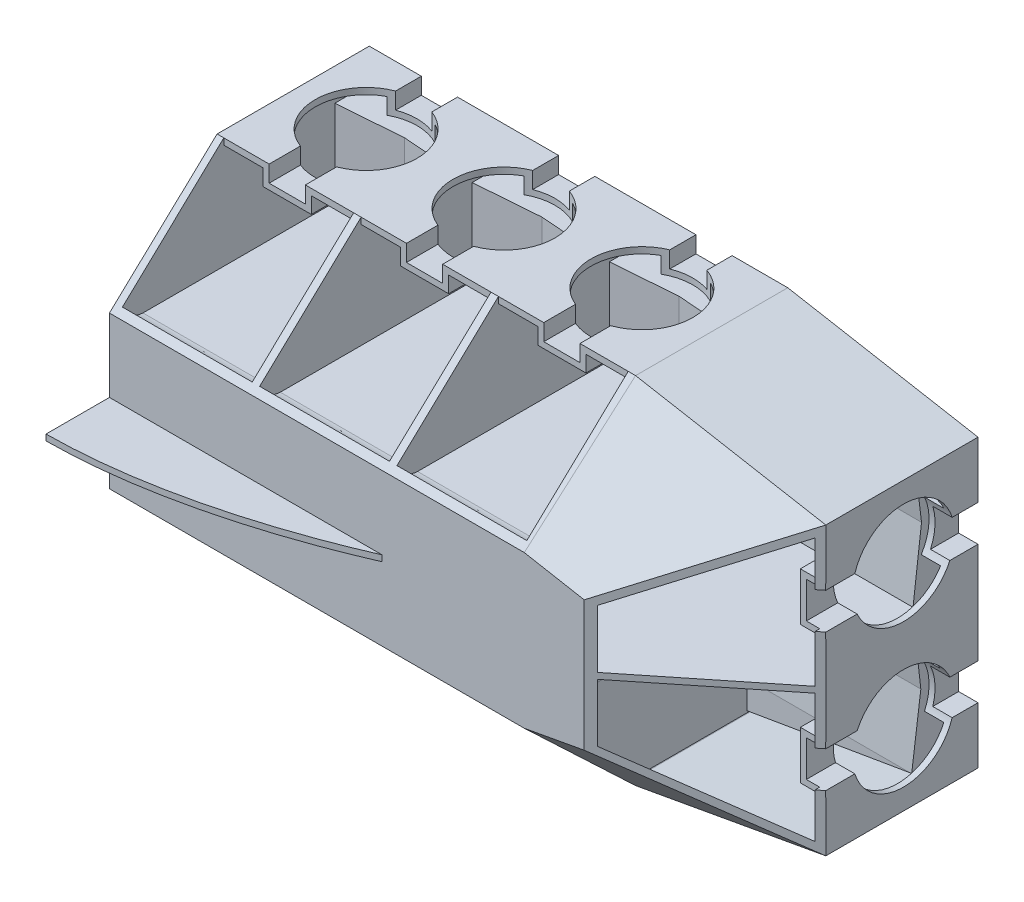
SolidWorks part; units mm, degrees
ref_plane "Front Plane" through (0, 0, 0) normal (0, 0, 1) x (1, 0, 0)
ref_plane "Top Plane" through (0, 0, 0) normal (0, 1, 0) x (1, 0, 0)
ref_plane "Right Plane" through (0, 0, 0) normal (1, 0, 0) x (0, 0, -1)
sketch "Sketch1" plane through (0, 0, 0) normal (0, 0, 1) x (1, 0, 0)
  line L1 (-60.96, 35.56) -> (60.96, 35.56)
  line L2 (-60.96, 35.56) -> (-60.96, -35.56)
  line L3 (-60.96, -35.56) -> (60.96, -35.56)
  line L4 (60.96, 35.56) -> (60.96, -35.56)
  line L5 (-60.96, 35.56) -> (60.96, -35.56) construction
  line L6 (-60.96, -35.56) -> (60.96, 35.56) construction
  point P0 (0, 0)
  dimension "D1" = 121.92
  dimension "D2" = 71.12
extrude "Boss-Extrude1" add sketch "Sketch1" along normal blind 30.48
sketch "Sketch2" plane through (0, 0, 30.48) normal (0, 0, 1) x (1, 0, 0)
  line L0 (0, 0) -> (60.96, 0) construction
  line L1 (60.96, -35.56) -> (60.96, 35.56) construction
  line L2 (60.96, 35.56) -> (60.96, 28.6956)
  line L3 (60.96, 35.56) -> (22.86, 35.56)
  line L4 (60.96, 35.56) -> (-60.96, 35.56) construction
  line L5 (22.86, 35.56) -> (60.96, 28.6956)
  line L6 (22.86, -35.56) -> (60.96, -28.6957)
  line L7 (60.96, -35.56) -> (22.86, -35.56)
  line L8 (60.96, -35.56) -> (60.96, -28.6957)
extrude "Cut-Extrude1" cut sketch "Sketch2" against normal through all
ref_plane "Plane1" through (0, 0, 50.8) normal (0, 0, 1) x (1, 0, 0)
sketch "Sketch3" plane through (0, 0, 50.8) normal (0, 0, 1) x (1, 0, 0)
  line L0 (34.0885, 0) -> (60.96, 0) construction
  line L2 (-61.0091, -15.24) -> (-61.0091, 15.24)
  line L3 (-61.0091, 15.24) -> (22.087, 15.24)
  line L4 (34.0885, -13.0429) -> (34.0885, 13.0429)
  line L5 (60.96, -28.6957) -> (60.96, 28.6956) construction
  line L6 (34.0885, 13.0429) -> (22.087, 15.24)
  line L7 (34.0885, -13.0429) -> (22.087, -15.24)
  line L8 (-61.0091, -15.24) -> (22.087, -15.24)
  point P8 (34.0885, 13.0429)
  point P9 (22.087, 15.24)
  dimension "D3" = 2.1971
extrude "Boss-Extrude2" add sketch "Sketch3" along normal blind 1.2 separate body
loft "Loft1" add
sketch "Sketch4" plane through (0, 0, 50.8) normal (0, 0, 1) x (1, 0, 0)
  line L0 (-42.0831, -34.29) -> (-33.6091, -34.29)
  line L1 (-59.6091, -15.29) -> (-33.6091, -15.29)
  line L2 (-59.6091, -15.29) -> (-59.6091, -34.29)
  line L3 (-59.6091, -34.29) -> (-51.7351, -34.29)
  line L4 (-33.6091, -15.29) -> (-33.6091, -34.29)
  line L5 (-61.0091, 0) -> (-61.0091, -52.4041) construction
  line L6 (-61.0091, 15.24) -> (-61.0091, -15.24) construction
  line L7 (-14.5831, -34.29) -> (-6.1091, -34.29)
  line L13 (-51.7351, -34.29) -> (-51.7351, -31.04)
  line L14 (-51.7351, -31.04) -> (-42.0831, -31.04)
  line L15 (-42.0831, -34.29) -> (-42.0831, -31.04)
  line L16 (-32.1091, -15.29) -> (-6.1091, -15.29)
  line L17 (-32.1091, -15.29) -> (-32.1091, -34.29)
  line L18 (-32.1091, -34.29) -> (-24.2351, -34.29)
  line L19 (-6.1091, -15.29) -> (-6.1091, -34.29)
  line L20 (-24.2351, -34.29) -> (-24.2351, -31.04)
  line L21 (-24.2351, -31.04) -> (-14.5831, -31.04)
  line L22 (-14.5831, -34.29) -> (-14.5831, -31.04)
  line L23 (-33.5091, 0) -> (-33.5091, -52.4041) construction
  line L24 (12.9169, -34.29) -> (21.3909, -34.29)
  line L25 (-4.6091, -15.29) -> (21.3909, -15.29)
  line L26 (-4.6091, -15.29) -> (-4.6091, -34.29)
  line L27 (-4.6091, -34.29) -> (3.2649, -34.29)
  line L28 (21.3909, -15.29) -> (21.3909, -34.29)
  line L29 (3.2649, -34.29) -> (3.2649, -31.04)
  line L30 (3.2649, -31.04) -> (12.9169, -31.04)
  line L31 (12.9169, -34.29) -> (12.9169, -31.04)
  line L32 (-6.0091, 0) -> (-6.0091, -52.4041) construction
  line L33 (-61.0091, 0) -> (34.27, 0) construction
  line L34 (12.9169, 34.29) -> (12.9169, 31.04)
  line L35 (3.2649, 31.04) -> (12.9169, 31.04)
  line L36 (3.2649, 34.29) -> (3.2649, 31.04)
  line L37 (21.3909, 15.29) -> (21.3909, 34.29)
  line L38 (-4.6091, 34.29) -> (3.2649, 34.29)
  line L39 (-4.6091, 15.29) -> (-4.6091, 34.29)
  line L40 (-4.6091, 15.29) -> (21.3909, 15.29)
  line L41 (12.9169, 34.29) -> (21.3909, 34.29)
  line L42 (-14.5831, 34.29) -> (-14.5831, 31.04)
  line L43 (-24.2351, 31.04) -> (-14.5831, 31.04)
  line L44 (-24.2351, 34.29) -> (-24.2351, 31.04)
  line L45 (-6.1091, 15.29) -> (-6.1091, 34.29)
  line L46 (-32.1091, 34.29) -> (-24.2351, 34.29)
  line L47 (-32.1091, 15.29) -> (-32.1091, 34.29)
  line L48 (-32.1091, 15.29) -> (-6.1091, 15.29)
  line L49 (-42.0831, 34.29) -> (-42.0831, 31.04)
  line L50 (-51.7351, 31.04) -> (-42.0831, 31.04)
  line L51 (-51.7351, 34.29) -> (-51.7351, 31.04)
  line L52 (-14.5831, 34.29) -> (-6.1091, 34.29)
  line L53 (-33.6091, 15.29) -> (-33.6091, 34.29)
  line L54 (-59.6091, 34.29) -> (-51.7351, 34.29)
  line L55 (-59.6091, 15.29) -> (-59.6091, 34.29)
  line L56 (-59.6091, 15.29) -> (-33.6091, 15.29)
  line L57 (-42.0831, 34.29) -> (-33.6091, 34.29)
  dimension "D1" = 19
  dimension "D2" = 1.4
  dimension "D3" = 26
  dimension "D4" = 3.25
  dimension "D5" = 3
extrude "Cut-Extrude2" cut sketch "Sketch4" against normal through all
shell "Shell2" thickness 1.2
ref_plane "Plane2" through (22.59, 0, 0) normal (1, 0, 0) x (0, 0, -1)
other "Intersect1"
sketch "Sketch5" plane through (0, 0, 52) normal (0, 0, 1) x (1, 0, 0)
  line L0 (-19.4091, 31.04) -> (-19.4091, -38.0658) construction
  line L1 (-24.2351, 31.04) -> (-14.5831, 31.04) construction
  line L2 (-19.4091, 31.04) -> (-19.4091, 41.9044) construction
  line L3 (-14.5831, 31.04) -> (-14.5831, 34.29) construction
  line L4 (-23.0351, 47.5938) -> (-15.7831, 47.5938)
  line L5 (-23.0351, 47.5938) -> (-23.0351, 32.24)
  line L6 (-23.0351, 32.24) -> (-15.7831, 32.24)
  line L7 (-15.7831, 47.5938) -> (-15.7831, 32.24)
  line L8 (-23.0351, 47.5938) -> (-15.7831, 32.24) construction
  line L9 (-23.0351, 32.24) -> (-15.7831, 47.5938) construction
  line L10 (4.4649, 47.5938) -> (11.7169, 47.5938)
  line L11 (4.4649, 47.5938) -> (4.4649, 32.24)
  line L12 (4.4649, 32.24) -> (11.7169, 32.24)
  line L13 (11.7169, 47.5938) -> (11.7169, 32.24)
  line L14 (4.4649, 47.5938) -> (11.7169, 32.24) construction
  line L15 (4.4649, 32.24) -> (11.7169, 47.5938) construction
  line L16 (-50.5351, 47.5938) -> (-43.2831, 47.5938)
  line L17 (-50.5351, 47.5938) -> (-50.5351, 32.24)
  line L18 (-50.5351, 32.24) -> (-43.2831, 32.24)
  line L19 (-43.2831, 47.5938) -> (-43.2831, 32.24)
  line L20 (-50.5351, 47.5938) -> (-43.2831, 32.24) construction
  line L21 (-50.5351, 32.24) -> (-43.2831, 47.5938) construction
  line L22 (-61.0091, 0) -> (34.0885, 0) construction
  line L23 (-61.0091, 15.24) -> (-61.0091, -15.24) construction
  line L24 (34.0885, -13.0429) -> (34.0885, 13.0429) construction
  line L25 (-50.5351, -32.24) -> (-43.2831, -47.5938) construction
  line L26 (-50.5351, -47.5938) -> (-43.2831, -32.24) construction
  line L27 (-43.2831, -47.5938) -> (-43.2831, -32.24)
  line L28 (-50.5351, -32.24) -> (-43.2831, -32.24)
  line L29 (-50.5351, -47.5938) -> (-50.5351, -32.24)
  line L30 (-50.5351, -47.5938) -> (-43.2831, -47.5938)
  line L31 (-23.0351, -32.24) -> (-15.7831, -47.5938) construction
  line L32 (-23.0351, -47.5938) -> (-15.7831, -32.24) construction
  line L33 (-15.7831, -47.5938) -> (-15.7831, -32.24)
  line L34 (-23.0351, -32.24) -> (-15.7831, -32.24)
  line L35 (-23.0351, -47.5938) -> (-23.0351, -32.24)
  line L36 (-23.0351, -47.5938) -> (-15.7831, -47.5938)
  line L37 (4.4649, -32.24) -> (11.7169, -47.5938) construction
  line L38 (4.4649, -47.5938) -> (11.7169, -32.24) construction
  line L39 (11.7169, -47.5938) -> (11.7169, -32.24)
  line L40 (4.4649, -32.24) -> (11.7169, -32.24)
  line L41 (4.4649, -47.5938) -> (4.4649, -32.24)
  line L42 (4.4649, -47.5938) -> (11.7169, -47.5938)
  point P4 (-19.4091, 39.9169)
  point P13 (8.0909, 39.9169)
  point P18 (-46.9091, 39.9169)
  point P32 (-46.9091, -39.9169)
  point P37 (-19.4091, -39.9169)
  point P42 (8.0909, -39.9169)
  dimension "D1" = 1.2
  dimension "D2" = 7.252
  dimension "D3" = 1.2
  dimension "D4" = 2
  dimension "D5" = 2
extrude "Cut-Extrude3" cut sketch "Sketch5" against normal through all
sketch "Sketch6" plane through (0, 0, 1.2) normal (0, 0, 1) x (1, 0, 0)
  line L0 (59.76, 27.6925) -> (59.76, -27.6925) construction
  line L1 (59.76, -27.6925) -> (59.76, 27.6925) construction
  line L2 (59.76, 0) -> (22.59, 0) construction
  line L3 (22.59, -14.09) -> (22.59, 14.09) construction
  line L5 (22.59, -0.6) -> (59.76, -0.6)
  line L7 (22.59, -0.6) -> (22.59, 0.6)
  line L8 (22.59, 0.6) -> (59.76, 0.6)
  line L9 (59.76, -0.6) -> (59.76, 0.6)
  dimension "D1" = 0.6
extrude "Boss-Extrude3" add sketch "Sketch6" along normal up to surface (49.6 mm away)
sketch "Sketch7" plane through (0, -0.6, 0) normal (0, -1, 0) x (1, 0, 0)
  line L0 (34.0885, 52) -> (60.96, 30.48)
  line L1 (60.96, 30.48) -> (60.96, 52.4326)
  line L2 (60.96, 52.4326) -> (34.0885, 52)
extrude "Cut-Extrude4" cut sketch "Sketch7" against normal blind 2
sketch "Sketch8" plane through (0, 35.56, 0) normal (0, 1, 0) x (1, 0, 0)
  line L0 (-46.9091, 0) -> (-46.9091, -33.9961) construction
  line L1 (-50.5351, 0) -> (-43.2831, 0) construction
  line L2 (-43.2831, -33.9961) -> (-50.5351, -33.9961) construction
  circle A0 centre (-46.9091, -14.6875) radius 10.2
  circle A1 centre (-19.2891, -14.6875) radius 10.2
  circle A2 centre (8.3309, -14.6875) radius 10.2
  dimension "D1" = 14.6875
extrude "Cut-Extrude5" cut sketch "Sketch8" against normal blind 6
sketch "Sketch9" plane through (0, -35.56, 0) normal (0, -1, 0) x (1, 0, 0)
  line L0 (-46.9091, 0) -> (-46.9091, 33.9961) construction
  line L1 (-43.2831, 0) -> (-50.5351, 0) construction
  line L2 (-50.5351, 33.9961) -> (-43.2831, 33.9961) construction
  circle A0 centre (-46.9091, 14.9225) radius 10.2
  circle A1 centre (-19.2891, 14.9225) radius 10.2
  circle A2 centre (8.3309, 14.9225) radius 10.2
  dimension "D1" = 14.9225
extrude "Cut-Extrude6" cut sketch "Sketch9" against normal blind 6
sketch "Sketch11" plane through (0, 0, 0) normal (0, 0, -1) x (-1, 0, 0)
  line L0 (-60.96, 0) -> (60.96, 0) construction
  line L1 (-60.96, -28.6957) -> (-60.96, 28.6956) construction
  line L2 (60.96, 35.56) -> (60.96, -35.56) construction
  line L3 (-55.88, -18.57) -> (-55.88, -8.92)
  line L4 (-60.96, 18.57) -> (-55.88, 18.57)
  line L5 (-60.96, 18.57) -> (-60.96, 8.92)
  line L6 (-60.96, 8.92) -> (-55.88, 8.92)
  line L7 (-55.88, 18.57) -> (-55.88, 8.92)
  line L8 (-60.96, -8.92) -> (-55.88, -8.92)
  line L9 (-60.96, -18.57) -> (-60.96, -8.92)
  line L10 (-60.96, -18.57) -> (-55.88, -18.57)
  dimension "D1" = 9.65
  dimension "D2" = 5.08
  dimension "D3" = 8.92
extrude "Boss-Extrude5" add sketch "Sketch11" against normal blind 30.5
sketch "Sketch12" plane through (0, 0, 0) normal (0, 0, -1) x (-1, 0, 0)
  line L0 (-60.96, 0) -> (60.96, 0) construction
  line L1 (-60.96, -28.6957) -> (-60.96, 28.6956) construction
  line L2 (60.96, 35.56) -> (60.96, -35.56) construction
  line L3 (-57.08, -17.37) -> (-57.08, -10.12)
  line L4 (-60.96, 17.37) -> (-57.08, 17.37)
  line L5 (-60.96, 17.37) -> (-60.96, 10.12)
  line L6 (-60.96, 10.12) -> (-57.08, 10.12)
  line L7 (-57.08, 17.37) -> (-57.08, 10.12)
  line L8 (-60.96, -10.12) -> (-57.08, -10.12)
  line L9 (-60.96, -17.37) -> (-60.96, -10.12)
  line L10 (-60.96, -17.37) -> (-57.08, -17.37)
  dimension "D1" = 3.88
  dimension "D2" = 7.25
  dimension "D3" = 10.12
extrude "Cut-Extrude8" cut sketch "Sketch12" against normal through all
sketch "Sketch10" plane through (60.96, 0, 0) normal (1, 0, 0) x (0, 0, -1)
  line L0 (-31.441, 5.36) -> (0, 5.36) construction
  line L1 (-31.441, 0.6) -> (-31.441, 10.12) construction
  line L2 (0, -28.6957) -> (0, -17.37) construction
  line L3 (-30.48, 0) -> (0, 0) construction
  line L5 (0, 0) -> (0, 28.6956) construction
  line L6 (0, 14.3478) -> (-33.7652, 14.3478) construction
  circle A0 centre (-14.9225, 14.3478) radius 10.2
  circle A1 centre (-14.9225, -14.3478) radius 10.2
  dimension "D1" = 14.9225
extrude "Cut-Extrude9" cut sketch "Sketch10" against normal blind 10
sketch "Sketch13" plane through (0, -35.56, 0) normal (0, -1, 0) x (1, 0, 0)
  line L0 (-60.96, 30.48) -> (22.86, 30.48) construction
  line L1 (-32.1076, 37.5203) -> (-6.1118, 37.5203)
  line L2 (-59.6076, 37.5203) -> (-33.6118, 37.5203)
  line L3 (-59.6076, 37.5203) -> (-59.6076, 30.48)
  line L4 (-59.6076, 30.48) -> (-33.6118, 30.48)
  line L5 (-33.6118, 37.5203) -> (-33.6118, 30.48)
  line L6 (-32.1076, 37.5203) -> (-32.1076, 30.48)
  line L7 (-32.1076, 30.48) -> (-6.1118, 30.48)
  line L8 (-6.1118, 37.5203) -> (-6.1118, 30.48)
  line L9 (-4.6076, 37.5203) -> (21.3882, 37.5203)
  line L10 (-4.6076, 37.5203) -> (-4.6076, 30.48)
  line L11 (-4.6076, 30.48) -> (21.3882, 30.48)
  line L12 (21.3882, 37.5203) -> (21.3882, 30.48)
extrude "Cut-Extrude11" cut sketch "Sketch13" against normal blind 10
sketch "Sketch14" plane through (0, 35.56, 0) normal (0, 1, 0) x (1, 0, 0)
  line L0 (-60.96, -30.48) -> (22.86, -30.48) construction
  line L1 (-59.6091, -50.8) -> (-59.6091, -31.825) construction
  line L2 (-59.6091, -37.2397) -> (-33.6091, -37.2397)
  line L3 (-59.6091, -37.2397) -> (-59.6091, -30.48)
  line L4 (-59.6091, -30.48) -> (-33.6091, -30.48)
  line L5 (-33.6091, -37.2397) -> (-33.6091, -30.48)
  line L6 (-33.6091, -31.825) -> (-33.6091, -50.8) construction
  line L7 (-32.1091, -37.2397) -> (-6.1091, -37.2397)
  line L8 (-32.1091, -37.2397) -> (-32.1091, -30.48)
  line L9 (-32.1091, -30.48) -> (-6.1091, -30.48)
  line L10 (-6.1091, -37.2397) -> (-6.1091, -30.48)
  line L11 (-4.6091, -37.2397) -> (21.3909, -37.2397)
  line L12 (-4.6091, -37.2397) -> (-4.6091, -30.48)
  line L13 (-4.6091, -30.48) -> (21.3909, -30.48)
  line L14 (21.3909, -37.2397) -> (21.3909, -30.48)
extrude "Cut-Extrude12" cut sketch "Sketch14" against normal blind 10
sketch "Sketch15" plane through (0, 0, 0) normal (0, 0, -1) x (-1, 0, 0)
  line L0 (4.6091, -15.29) -> (4.6091, -34.29) construction
  line L1 (-21.3909, -15.29) -> (4.6091, -15.29)
  line L2 (-21.3909, -15.29) -> (-21.3909, -30.4528)
  line L3 (-21.3909, -30.4528) -> (4.6091, -30.4528)
  line L4 (4.6091, -15.29) -> (4.6091, -30.4528)
  line L13 (-60.96, 0) -> (60.96, 0) construction
  line L14 (-60.96, -10.12) -> (-60.96, 10.12) construction
  line L15 (60.96, 35.56) -> (60.96, -35.56) construction
  line L28 (-21.3909, -15.29) -> (4.6091, -15.29) construction
  line L29 (6.1091, -15.29) -> (6.1091, -30.4528)
  line L30 (6.1091, -15.29) -> (32.1091, -15.29)
  line L31 (32.1091, -15.29) -> (32.1091, -30.4528)
  line L32 (6.1091, -30.4528) -> (32.1091, -30.4528)
  line L33 (33.6091, -15.29) -> (33.6091, -30.4528)
  line L34 (33.6091, -15.29) -> (59.6091, -15.29)
  line L35 (59.6091, -15.29) -> (59.6091, -30.4528)
  line L36 (33.6091, -30.4528) -> (59.6091, -30.4528)
  line L37 (33.6091, 30.4528) -> (59.6091, 30.4528)
  line L38 (59.6091, 15.29) -> (59.6091, 30.4528)
  line L39 (33.6091, 15.29) -> (59.6091, 15.29)
  line L40 (33.6091, 15.29) -> (33.6091, 30.4528)
  line L41 (6.1091, 30.4528) -> (32.1091, 30.4528)
  line L42 (32.1091, 15.29) -> (32.1091, 30.4528)
  line L43 (6.1091, 15.29) -> (32.1091, 15.29)
  line L44 (6.1091, 15.29) -> (6.1091, 30.4528)
  line L45 (4.6091, 15.29) -> (4.6091, 30.4528)
  line L46 (-21.3909, 30.4528) -> (4.6091, 30.4528)
  line L47 (-21.3909, 15.29) -> (-21.3909, 30.4528)
  line L48 (-21.3909, 15.29) -> (4.6091, 15.29)
extrude "Boss-Extrude6" add sketch "Sketch15" against normal blind 8.255
sketch "Sketch19" plane through (0, 0, 1.2) normal (0, 0, 1) x (1, 0, 0)
  line L0 (22.59, 0.6) -> (22.7528, 34.36)
  line L1 (22.7528, 34.36) -> (55.88, 28.3916)
  line L7 (55.88, 0.6) -> (22.59, 0.6)
  line L8 (61.087, 0) -> (14.2317, 0.2259) construction
  line L11 (55.88, 28.3916) -> (55.88, 0.6)
  line L12 (55.8745, -0.5498) -> (22.586, -0.2288)
  line L13 (22.586, -0.2288) -> (22.4232, -33.9888)
  line L14 (55.6065, -28.34) -> (55.8745, -0.5498)
  line L15 (22.4232, -33.9888) -> (55.6065, -28.34)
extrude "Boss-Extrude8" add sketch "Sketch19" along normal blind 6.731
sketch "Sketch20" plane through (55.88, 0, 0) normal (1, 0, 0) x (0, 0, -1)
  line L0 (-7.931, 14.4958) -> (0.3326, 14.4958) construction
  line L1 (-7.931, 0.6) -> (-7.931, 28.3916) construction
  line L2 (-7.931, 28.3916) -> (-6.2303, 14.4958)
  line L3 (-6.2303, 14.4958) -> (-7.931, 0.6)
  line L4 (-7.931, 0.6) -> (-7.931, 28.3916)
  line L5 (-30.48, 0) -> (0, 0) construction
  line L6 (-30.48, -8.92) -> (-30.48, 8.92) construction
  line L7 (-7.931, -28.3916) -> (-6.2303, -14.4958)
  line L8 (-7.931, -0.6) -> (-7.931, -28.3916)
  line L9 (-6.2303, -14.4958) -> (-7.931, -0.6)
extrude "Cut-Extrude15" cut sketch "Sketch20" against normal up to surface (33.29 mm away)
sketch "Sketch21" plane through (0, 30.4528, 0) normal (0, 1, 0) x (1, 0, 0)
  line L0 (8.3909, -8.255) -> (8.0909, 0) construction
  line L1 (-4.6091, -8.255) -> (21.3909, -8.255) construction
  line L2 (4.4649, 0) -> (11.7169, 0) construction
  line L3 (-4.6091, -8.255) -> (8.3546, -7.2557)
  line L4 (8.3546, -7.2557) -> (21.3909, -8.255)
  line L5 (21.3909, -8.255) -> (-4.6091, -8.255)
  line L6 (-32.1091, -8.255) -> (-19.1454, -7.2557)
  line L7 (-19.1454, -7.2557) -> (-6.1091, -8.255)
  line L8 (-6.1091, -8.255) -> (-32.1091, -8.255)
  line L9 (-59.6091, -8.255) -> (-46.6454, -7.2557)
  line L10 (-46.6454, -7.2557) -> (-33.6091, -8.255)
  line L11 (-33.6091, -8.255) -> (-59.6091, -8.255)
  dimension "D1" = 1
extrude "Cut-Extrude16" cut sketch "Sketch21" against normal up to surface (15.1628 mm away)
sketch "Sketch22" plane through (0, -30.4528, 0) normal (0, -1, 0) x (1, 0, 0)
  line L0 (-46.6091, 8.255) -> (-46.6091, 0) construction
  line L1 (-33.6091, 8.255) -> (-59.6091, 8.255) construction
  line L2 (-59.6091, 8.255) -> (-46.6091, 7.255)
  line L3 (-46.6091, 7.255) -> (-33.6091, 8.255)
  line L4 (-33.6091, 8.255) -> (-59.6091, 8.255)
  line L5 (-32.1091, 8.255) -> (-19.1091, 7.255)
  line L6 (-19.1091, 7.255) -> (-6.1091, 8.255)
  line L7 (-6.1091, 8.255) -> (-32.1091, 8.255)
  line L8 (-4.6091, 8.255) -> (8.3909, 7.255)
  line L9 (8.3909, 7.255) -> (21.3909, 8.255)
  line L10 (21.3909, 8.255) -> (-4.6091, 8.255)
  dimension "D1" = 1
extrude "Cut-Extrude17" cut sketch "Sketch22" against normal up to surface (15.1628 mm away)
sketch "Sketch23" plane through (0, 0, 52) normal (0, 0, 1) x (1, 0, 0)
  line L0 (-61.0091, 0) -> (34.0885, 0) construction
  line L1 (-61.0091, 15.24) -> (-61.0091, -15.24) construction
  line L2 (34.0885, -13.0429) -> (34.0885, 13.0429) construction
  line L3 (-61.0091, -0.6) -> (-6.3991, -0.6)
  line L5 (-61.0091, -0.6) -> (-61.0091, 0.6)
  line L6 (-61.0091, 0.6) -> (-6.3991, 0.6)
  line L7 (-6.3991, -0.6) -> (-6.3991, 0.6)
  dimension "D1" = 0.6
  dimension "D2" = 54.61
extrude "Boss-Extrude9" add sketch "Sketch23" along normal blind 12.7
sketch "Sketch24" plane through (0, -0.6, 0) normal (0, -1, 0) x (1, 0, 0)
  line L0 (-47.3566, 52) -> (-47.3566, 64.7) construction
  line L1 (-61.0091, 52) -> (-6.3991, 52) construction
  line L2 (-61.0091, 64.7) -> (-6.3991, 64.7) construction
  line L3 (-61.0091, 64.7) -> (-61.0091, 52) construction
  line L4 (-33.7066, 52) -> (-33.7066, 64.7) construction
  line L5 (-20.0566, 52) -> (-20.0566, 64.7) construction
  line L6 (-6.3991, 52) -> (0, 58.3991)
  line L7 (0, 58.3991) -> (0, 69.8352)
  line L8 (0, 69.8352) -> (-63.4418, 69.8352)
  line L9 (-63.4418, 69.8352) -> (-63.4418, 64.7)
  line L10 (-63.4418, 64.7) -> (-61.0091, 64.7)
  spline S0 degree 3 poles (-61.0091, 64.7) (-51.7995, 64.6346) (-33.0813, 61.956) (-15.2149, 55.8378) (-6.3991, 52) knots 0 0 0 0 0.488733 1 1 1 1
  point P8 (-47.3566, 58.35)
  point P9 (-47.3566, 63.7348)
  point P14 (-33.7066, 61.1948)
  point P15 (-20.0566, 57.2705)
  dimension "D1" = 13.6525
  dimension "D2" = 11.7348
  dimension "D3" = 9.1948
  dimension "D4" = 5.2705
extrude "Cut-Extrude18" cut sketch "Sketch24" against normal blind 12.7
sketch "Sketch25" plane through (-4.6091, 0, 0) normal (1, 0, 0) x (0, 0, -1)
  line L0 (-50.6744, 15.29) -> (-8.255, 15.29) construction
  line L1 (-8.255, 15.29) -> (-50.8, 15.29) construction
  line L2 (-50.6744, 13.29) -> (-46.6744, 13.29) construction
  line L3 (-50.6744, 15.29) -> (-8.255, 15.29)
  line L4 (-45.9779, 13.29) -> (-8.255, 13.29) construction
  line L5 (-8.255, 15.29) -> (-8.255, 13.29)
  line L6 (-8.255, 13.29) -> (-46.6744, 13.29)
  spline S0 degree 2 poles (-50.6744, 15.29) (-48.8786, 13.4248) (-46.6744, 13.29) knots 0 0 0 0.865242 0.865242 0.865242
  point P5 (-46.6744, 13.29)
  dimension "D2" = 4
  dimension "D1" = 2
extrude "Cut-Extrude19" cut sketch "Sketch25" along normal blind 26
pattern_linear "LPattern1" count 3 spacing 27.5 along (-1, 0, 0) of "Cut-Extrude19"
sketch "Sketch26" plane through (-4.6091, 0, 0) normal (1, 0, 0) x (0, 0, -1)
  line L0 (-50.5261, -15.29) -> (-8.255, -15.29) construction
  line L1 (-8.255, -15.29) -> (-50.8, -15.29) construction
  line L2 (-50.5261, -13.29) -> (-8.255, -13.29) construction
  line L3 (-50.5261, -15.29) -> (-8.255, -15.29)
  line L4 (-8.255, -15.29) -> (-8.255, -13.29)
  line L5 (-8.255, -13.29) -> (-48.5261, -13.29)
  spline S0 degree 3 poles (-50.5261, -15.29) (-50.2945, -14.216) (-49.2485, -13.5084) (-48.5261, -13.29) knots 0 0 0 0 1 1 1 1
  point P5 (-48.5261, -13.29)
  dimension "D2" = 2
  dimension "D1" = 2
extrude "Cut-Extrude20" cut sketch "Sketch26" along normal blind 26
pattern_linear "LPattern2" count 3 spacing 27.5 along (-1, 0, 0) of "Cut-Extrude20"
